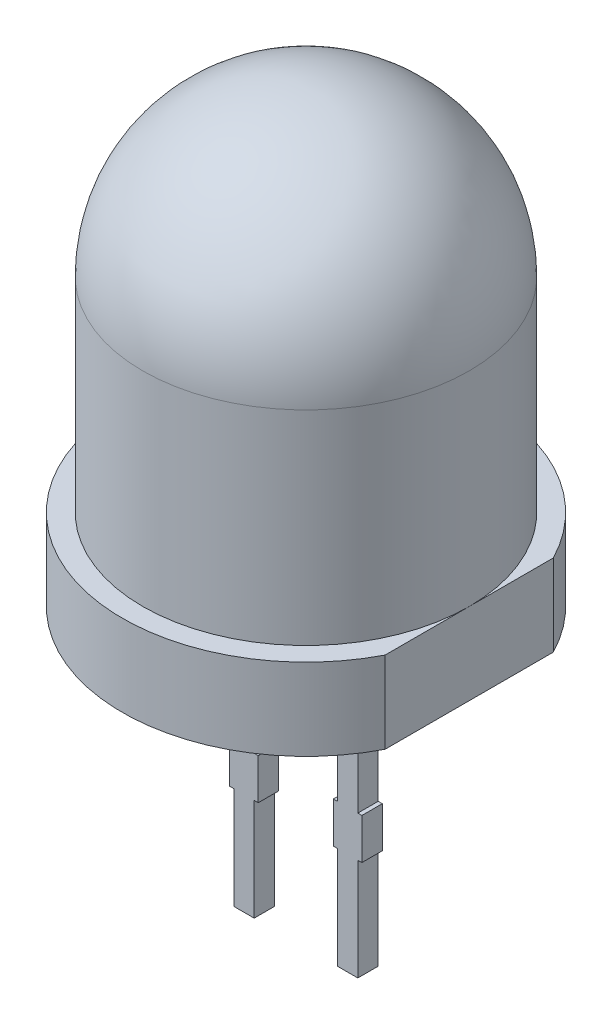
SolidWorks part; units mm, degrees
ref_plane "Front" through (0, 0, 0) normal (0, 0, 1) x (1, 0, 0)
ref_plane "Top" through (0, 0, 0) normal (0, 1, 0) x (1, 0, 0)
ref_plane "Right" through (0, 0, 0) normal (1, 0, 0) x (0, 0, -1)
sketch "Эскиз1" plane through (0, 0, 0) normal (0, 0, 1) x (1, 0, 0)
  line L0 (0, 4.5) -> (0, 15.5) construction
  line L1 (4, 11.5) -> (4, 6.5)
  line L2 (4, 6.5) -> (4.5, 6.5)
  line L3 (4.5, 6.5) -> (4.5, 4.5)
  line L4 (4.5, 4.5) -> (0, 4.5)
  line L5 (0, 4.5) -> (0, 15.5)
  line L6 (0, 0) -> (0, 4.5) construction
  arc A0 (0, 15.5) -> (4, 11.5) centre (0, 11.5) cw
  dimension "D1" = 8
  dimension "D2" = 9
  dimension "D3" = 11
  dimension "D4" = 2
  dimension "D5" = 4.5
revolve "Повернуть1" add sketch "Эскиз1" angle 360 about L0
sketch "Эскиз3" plane through (0, 6.5, 0) normal (0, 1, 0) x (1, 0, 0)
  line L0 (4, 2.0616) -> (4, -2.0616)
  circle A0 centre (0, 0) radius 4.5 construction
  circle A1 centre (0, 0) radius 4 construction
  arc A2 (4, -2.0616) -> (4, 2.0616) centre (0, 0) ccw
extrude "Вытянуть2" cut sketch "Эскиз3" against normal up to next
sketch "Эскиз2" plane through (0, 0, 0) normal (0, 0, 1) x (1, 0, 0)
  line L0 (0, 0) -> (0, -2.5) construction
  line L1 (-1.27, 4.5) -> (-1.27, -2.5) construction
  line L2 (-4.5, 4.5) -> (4, 4.5) construction
  line L3 (-1.52, 4.5) -> (-1.52, 1)
  line L4 (-1.52, 1) -> (-1.62, 1)
  line L5 (-1.62, 1) -> (-1.62, 0)
  line L6 (-1.62, 0) -> (-1.52, 0)
  line L7 (-1.52, 0) -> (-1.52, -2.5)
  line L8 (-1.52, -2.5) -> (-1.02, -2.5)
  line L9 (-1.52, 4.5) -> (-1.02, 4.5)
  line L10 (-1.02, 0) -> (-1.02, -2.5)
  line L11 (-0.92, 0) -> (-1.02, 0)
  line L12 (-0.92, 1) -> (-0.92, 0)
  line L13 (-1.02, 1) -> (-0.92, 1)
  line L14 (-1.02, 4.5) -> (-1.02, 1)
  line L15 (1.02, 4.5) -> (1.02, 1)
  line L16 (1.02, 1) -> (0.92, 1)
  line L17 (0.92, 1) -> (0.92, 0)
  line L18 (0.92, 0) -> (1.02, 0)
  line L19 (1.02, 0) -> (1.02, -2.5)
  line L20 (1.52, 4.5) -> (1.02, 4.5)
  line L21 (1.52, -2.5) -> (1.02, -2.5)
  line L22 (1.52, 0) -> (1.52, -2.5)
  line L23 (1.62, 0) -> (1.52, 0)
  line L24 (1.62, 1) -> (1.62, 0)
  line L25 (1.52, 1) -> (1.62, 1)
  line L26 (1.52, 4.5) -> (1.52, 1)
  line L27 (1.27, -2.5) -> (1.27, 4.5) construction
  dimension "D1" = 0.5
  dimension "D2" = 0.7
  dimension "D4" = 1
  dimension "D5" = 2.5
  dimension "D6" = 2.54
extrude "Вытянуть1" add sketch "Эскиз2" along normal mid plane 0.5
